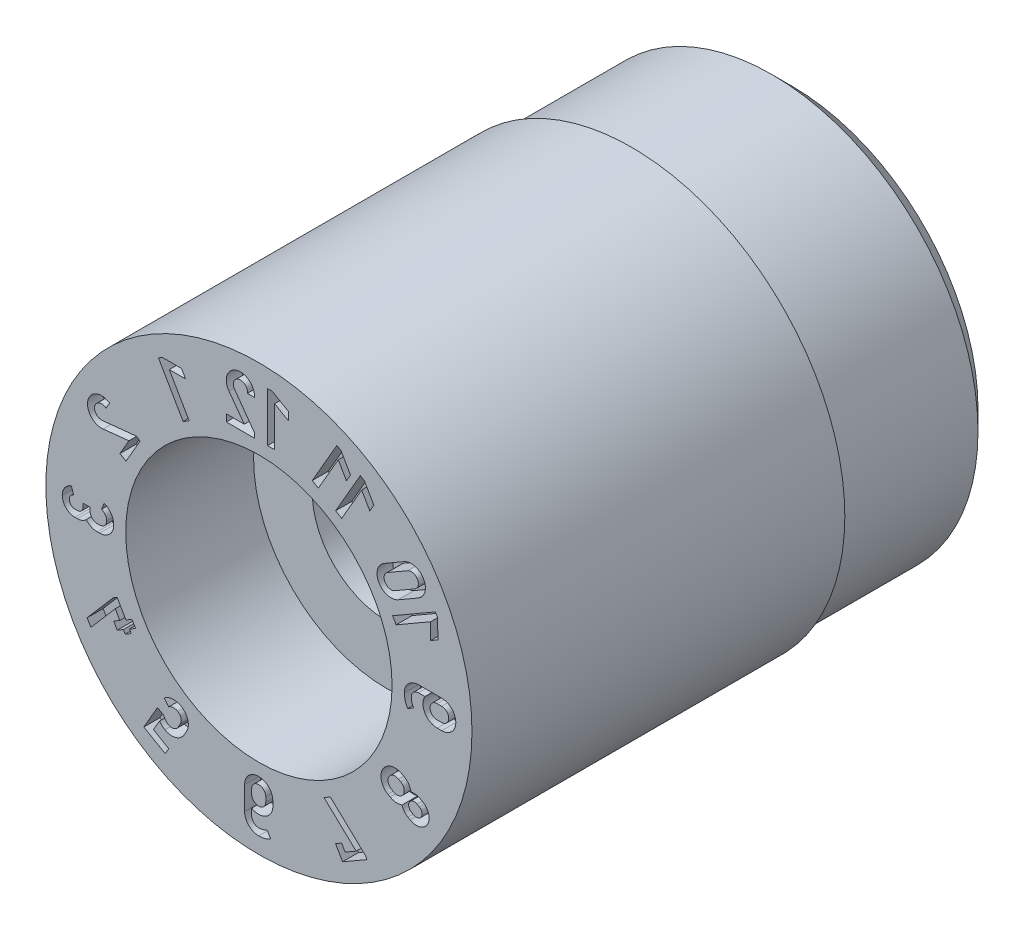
SolidWorks part; units mm, degrees
ref_plane "Front Plane" through (0, 0, 0) normal (0, 0, 1) x (1, 0, 0)
ref_plane "Top Plane" through (0, 0, 0) normal (0, 1, 0) x (1, 0, 0)
ref_plane "Right Plane" through (0, 0, 0) normal (1, 0, 0) x (0, 0, -1)
sketch "Sketch1" plane through (0, 0, 0) normal (1, 0, 0) x (0, 0, -1)
  line L2 (0, 2) -> (0, 1.25)
  line L3 (4.75, 2) -> (0, 2)
  line L4 (-3.7979, 0) -> (49996.2021, 0) construction
  line L8 (5, 0.7) -> (1.2, 0.7)
  line L9 (1.2, 1.25) -> (1.2, 0.7)
  line L10 (1.2, 1.25) -> (0, 1.25)
  line L12 (5, 0.7) -> (5, 1.75)
  line L16 (5, 1.75) -> (4.75, 2)
  dimension "D1" = 5
  dimension "D2" = 45
  dimension "D3" = 0.25
  dimension "D4" = 4
  dimension "D5" = 2.5
  dimension "D6" = 1.2
  dimension "D7" = 1.4
revolve "Revolve1" add sketch "Sketch1" angle 360 about L4
sketch "Sketch5" plane through (0, 0, 0) normal (1, 0, 0) x (0, 0, -1)
  line L0 (0, 0) -> (50000, 0) construction
  line L1 (0, 2) -> (0, -2) construction
  line L2 (3.5, 1.935) -> (5, 1.935)
  line L3 (3.5, 1.935) -> (3.5, 2.935)
  line L4 (3.5, 2.935) -> (5, 2.935)
  line L5 (5, 1.935) -> (5, 2.935)
  line L6 (5, -1.75) -> (5, 1.75) construction
  line L7 (4.75, 2) -> (0, 2) construction
  dimension "D1" = 3.5
  dimension "D2" = 0.065
  dimension "D3" = 1
revolve "Cut-Revolve1" cut sketch "Sketch5" angle 360 about L0
sketch "Sketch2" plane through (0, 0, 0) normal (0, 0, 1) x (1, 0, 0)
  line L0 (0.9518, 1.5571) -> (0.9896, 1.5353)
  line L1 (0.9896, 1.5353) -> (1.0793, 1.3805)
  line L2 (1.0793, 1.3805) -> (1.0411, 1.3144)
  line L3 (1.0411, 1.3144) -> (0.9645, 1.4466)
  line L4 (0.9645, 1.4466) -> (0.7774, 1.1225)
  line L5 (0.7774, 1.1225) -> (0.72, 1.1556)
  line L6 (0.72, 1.1556) -> (0.9518, 1.5571)
  line L7 (0.7323, 1.6929) -> (0.7701, 1.6711)
  line L8 (0.7701, 1.6711) -> (0.8598, 1.5163)
  line L9 (0.8598, 1.5163) -> (0.8216, 1.4501)
  line L10 (0.8216, 1.4501) -> (0.7449, 1.5823)
  line L11 (0.7449, 1.5823) -> (0.5578, 1.2582)
  line L12 (0.5578, 1.2582) -> (0.5005, 1.2914)
  line L13 (0.5005, 1.2914) -> (0.7323, 1.6929)
  line L14 (1.2744, 0.783) -> (1.4637, 0.8923)
  line L15 (1.3975, 1.007) -> (1.2081, 0.8977)
  line L16 (1.7158, 0.0644) -> (1.6728, 0.0644)
  line L17 (1.6728, -0.068) -> (1.7158, -0.068)
  line L18 (1.7158, 0.1307) -> (1.4972, 0.1307)
  line L19 (1.396, -0.1144) -> (1.4529, -0.0802)
  line L20 (1.7157, -0.1342) -> (1.6728, -0.1344)
  line L21 (1.558, 0.0644) -> (1.4972, 0.0644)
  line L22 (1.4321, -0.9387) -> (1.4522, -0.9502)
  line L23 (1.5052, -0.8585) -> (1.4851, -0.8469)
  line L24 (0.6108, -1.2306) -> (0.6707, -1.196)
  line L25 (0.6707, -1.196) -> (0.9988, -1.5052)
  line L26 (0.9988, -1.5052) -> (1.0147, -1.5328)
  line L27 (1.0147, -1.5328) -> (0.7853, -1.6653)
  line L28 (0.7853, -1.6653) -> (0.719, -1.5505)
  line L29 (0.719, -1.5505) -> (0.7764, -1.5174)
  line L30 (0.7764, -1.5174) -> (0.8095, -1.5748)
  line L31 (0.8095, -1.5748) -> (0.9128, -1.5152)
  line L32 (0.9128, -1.5152) -> (0.6108, -1.2306)
  line L33 (1.2448, -0.8458) -> (1.2649, -0.8574)
  line L34 (1.3311, -0.7427) -> (1.3111, -0.731)
  line L35 (1.3642, -0.6853) -> (1.3442, -0.6737)
  line L36 (1.2117, -0.9031) -> (1.2318, -0.9147)
  line L37 (1.399, -0.996) -> (1.4191, -1.0076)
  line L38 (1.5383, -0.8011) -> (1.5182, -0.7895)
  line L39 (1.6568, 0.8019) -> (1.6786, 0.7641)
  line L40 (1.6786, 0.7641) -> (1.6789, 0.5852)
  line L41 (1.6789, 0.5852) -> (1.6128, 0.547)
  line L42 (1.6128, 0.547) -> (1.6125, 0.6998)
  line L43 (1.6125, 0.6998) -> (1.2884, 0.5127)
  line L44 (1.2884, 0.5127) -> (1.2553, 0.5701)
  line L45 (1.2553, 0.5701) -> (1.6568, 0.8019)
  line L46 (1.3643, 1.0644) -> (1.175, 0.9551)
  line L47 (1.3075, 0.7256) -> (1.4968, 0.8349)
  line L48 (0.0813, 1.8293) -> (0.1249, 1.8293)
  line L49 (0.1249, 1.8293) -> (0.28, 1.7401)
  line L50 (0.28, 1.7401) -> (0.28, 1.6637)
  line L51 (0.28, 1.6637) -> (0.1475, 1.7399)
  line L52 (0.1475, 1.7399) -> (0.1475, 1.3656)
  line L53 (0.1475, 1.3656) -> (0.0813, 1.3656)
  line L54 (0.0813, 1.3656) -> (0.0813, 1.8293)
  line L55 (-0.306, 1.3646) -> (-0.041, 1.3646)
  line L56 (-0.041, 1.3646) -> (-0.041, 1.4084)
  line L57 (-0.041, 1.4084) -> (-0.2273, 1.667)
  line L58 (-0.108, 1.6958) -> (-0.0414, 1.6958)
  line L59 (-0.2811, 1.6282) -> (-0.137, 1.4309)
  line L60 (-0.137, 1.4309) -> (-0.306, 1.4309)
  line L61 (-0.306, 1.4309) -> (-0.306, 1.3646)
  line L62 (-0.9431, 1.5673) -> (-0.9054, 1.5891)
  line L63 (-0.9054, 1.5891) -> (-0.7264, 1.5894)
  line L64 (-0.7264, 1.5894) -> (-0.6882, 1.5233)
  line L65 (-0.6882, 1.5233) -> (-0.8411, 1.523)
  line L66 (-0.8411, 1.523) -> (-0.6539, 1.1989)
  line L67 (-0.6539, 1.1989) -> (-0.7113, 1.1658)
  line L68 (-0.7113, 1.1658) -> (-0.9431, 1.5673)
  line L69 (-0.068, -1.4973) -> (-0.068, -1.5403)
  line L70 (0.0644, -1.5403) -> (0.0644, -1.4973)
  line L71 (0.1306, -1.4974) -> (0.1308, -1.5403)
  line L72 (-0.068, -1.6551) -> (-0.068, -1.7159)
  line L73 (-0.1343, -1.4973) -> (-0.1343, -1.7159)
  line L74 (0.1108, -1.8171) -> (0.0766, -1.7602)
  line L75 (-0.6803, -1.3396) -> (-0.7019, -1.3769)
  line L76 (-0.9518, -1.2799) -> (-0.8944, -1.313)
  line L77 (-0.7592, -1.3438) -> (-0.7377, -1.3065)
  line L78 (-0.8474, -1.2224) -> (-0.8886, -1.1705)
  line L79 (-0.9518, -1.2799) -> (-1.0803, -1.5026)
  line L80 (-1.0803, -1.5026) -> (-0.8796, -1.6185)
  line L81 (-0.8796, -1.6185) -> (-0.8464, -1.5611)
  line L82 (-0.8464, -1.5611) -> (-0.9899, -1.4783)
  line L83 (-0.9899, -1.4783) -> (-0.9333, -1.3803)
  line L84 (-1.7268, -0.1207) -> (-1.7036, -0.1207)
  line L85 (-1.5182, -0.1339) -> (-1.495, -0.1339)
  line L86 (-1.4527, 0.131) -> (-1.477, 0.0694)
  line L87 (-1.7605, 0.1178) -> (-1.7393, 0.055)
  line L88 (-1.7268, -0.0544) -> (-1.7036, -0.0544)
  line L89 (-1.6506, -0.0014) -> (-1.6506, 0.0317)
  line L90 (-1.6506, 0.0317) -> (-1.5844, 0.0317)
  line L91 (-1.5844, 0.0317) -> (-1.5844, -0.0015)
  line L92 (-1.5182, -0.0677) -> (-1.495, -0.0677)
  line L93 (-1.6122, -0.88) -> (-1.5771, -0.9408)
  line L94 (-1.5771, -0.9408) -> (-1.3483, -0.6748)
  line L95 (-1.3483, -0.6748) -> (-1.3054, -0.7491)
  line L96 (-1.3054, -0.7491) -> (-1.3627, -0.7823)
  line L97 (-1.3627, -0.7823) -> (-1.3296, -0.8396)
  line L98 (-1.3296, -0.8396) -> (-1.2723, -0.8065)
  line L99 (-1.2723, -0.8065) -> (-1.2557, -0.8352)
  line L100 (-1.2557, -0.8352) -> (-1.1983, -0.8021)
  line L101 (-1.1983, -0.8021) -> (-1.2149, -0.7734)
  line L102 (-1.2149, -0.7734) -> (-1.1575, -0.7403)
  line L103 (-1.1575, -0.7403) -> (-1.1906, -0.6829)
  line L104 (-1.1906, -0.6829) -> (-1.248, -0.716)
  line L105 (-1.248, -0.716) -> (-1.3308, -0.5726)
  line L106 (-1.3308, -0.5726) -> (-1.3644, -0.592)
  line L107 (-1.3644, -0.592) -> (-1.6122, -0.88)
  line L108 (-1.3045, 0.6084) -> (-1.2471, 0.5753)
  line L109 (-1.2471, 0.5753) -> (-1.1147, 0.8047)
  line L110 (-1.1147, 0.8047) -> (-1.1526, 0.8266)
  line L111 (-1.1526, 0.8266) -> (-1.4697, 0.7946)
  line L112 (-1.435, 0.9123) -> (-1.4017, 0.97)
  line L113 (-1.463, 0.7286) -> (-1.2201, 0.7547)
  line L114 (-1.2201, 0.7547) -> (-1.3045, 0.6084)
  arc A0 (1.2081, 0.8977) -> (1.2744, 0.783) centre (1.2413, 0.8403) ccw
  arc A1 (1.4637, 0.8923) -> (1.3975, 1.007) centre (1.4306, 0.9496) ccw
  arc A2 (1.6728, 0.0644) -> (1.6728, -0.068) centre (1.6728, -0.0018) ccw
  arc A3 (1.7158, -0.068) -> (1.7158, 0.0644) centre (1.7158, -0.0018) ccw
  arc A4 (1.4972, 0.1307) -> (1.3648, -0.0018) centre (1.4973, -0.0018) ccw
  arc A5 (1.3648, -0.0018) -> (1.396, -0.1144) centre (1.5832, -0.0019) ccw
  arc A6 (1.7157, -0.1342) -> (1.7158, 0.1307) centre (1.7158, -0.0018) ccw
  arc A7 (1.558, 0.0644) -> (1.6728, -0.1344) centre (1.6723, -0.0021) ccw
  arc A8 (1.4972, 0.0644) -> (1.4312, 0.0033) centre (1.4972, -0.0018) ccw
  arc A9 (1.4312, 0.0033) -> (1.4529, -0.0802) centre (1.5637, -0.0069) ccw
  arc A10 (1.4851, -0.8469) -> (1.4321, -0.9387) centre (1.4586, -0.8927) ccw
  arc A11 (1.4522, -0.9502) -> (1.5052, -0.8585) centre (1.4787, -0.9043) ccw
  arc A12 (1.3111, -0.731) -> (1.2448, -0.8458) centre (1.278, -0.7884) ccw
  arc A13 (1.2649, -0.8574) -> (1.3311, -0.7427) centre (1.298, -0.8) ccw
  arc A14 (1.4285, -0.7774) -> (1.3642, -0.6853) centre (1.298, -0.8) ccw
  arc A15 (1.3442, -0.6737) -> (1.2117, -0.9031) centre (1.2779, -0.7884) ccw
  arc A16 (1.2318, -0.9147) -> (1.3437, -0.9244) centre (1.298, -0.8) ccw
  arc A17 (1.3437, -0.9244) -> (1.399, -0.996) centre (1.4588, -0.8927) ccw
  arc A18 (1.4191, -1.0076) -> (1.5383, -0.8011) centre (1.4787, -0.9044) ccw
  arc A19 (1.5182, -0.7895) -> (1.4285, -0.7774) centre (1.4588, -0.8917) ccw
  arc A20 (1.175, 0.9551) -> (1.3075, 0.7256) centre (1.2413, 0.8403) ccw
  arc A21 (1.4968, 0.8349) -> (1.3643, 1.0644) centre (1.4306, 0.9496) ccw
  arc A22 (-0.108, 1.6958) -> (-0.2273, 1.667) centre (-0.1735, 1.7057) ccw
  arc A23 (-0.0414, 1.6958) -> (-0.2811, 1.6282) centre (-0.1735, 1.7057) ccw
  arc A24 (-0.068, -1.5403) -> (0.0644, -1.5403) centre (-0.0018, -1.5403) ccw
  arc A25 (0.0644, -1.4973) -> (-0.068, -1.4973) centre (-0.0018, -1.4973) ccw
  arc A26 (0.1306, -1.4974) -> (-0.1343, -1.4973) centre (-0.0018, -1.4973) ccw
  arc A27 (-0.068, -1.6551) -> (0.1308, -1.5403) centre (-0.0015, -1.5408) ccw
  arc A28 (-0.068, -1.7159) -> (-0.0069, -1.7819) centre (-0.0018, -1.7159) ccw
  arc A29 (-0.0069, -1.7819) -> (0.0766, -1.7602) centre (0.0033, -1.6494) ccw
  arc A30 (-0.1343, -1.7159) -> (-0.0018, -1.8483) centre (-0.0018, -1.7158) ccw
  arc A31 (-0.0018, -1.8483) -> (0.1108, -1.8171) centre (-0.0017, -1.6299) ccw
  arc A32 (-0.8828, -1.4254) -> (-0.7019, -1.3769) centre (-0.8167, -1.3104) ccw
  arc A33 (-0.9333, -1.3803) -> (-0.8828, -1.4254) centre (-0.801, -1.2831) ccw
  arc A34 (-0.6803, -1.3396) -> (-0.7288, -1.1587) centre (-0.7952, -1.2734) ccw
  arc A35 (-0.7288, -1.1587) -> (-0.8886, -1.1705) centre (-0.8001, -1.2819) ccw
  arc A36 (-0.8944, -1.313) -> (-0.8497, -1.3681) centre (-0.8, -1.2819) ccw
  arc A37 (-0.8497, -1.3681) -> (-0.7592, -1.3438) centre (-0.8166, -1.3107) ccw
  arc A38 (-0.7377, -1.3065) -> (-0.7619, -1.216) centre (-0.795, -1.2734) ccw
  arc A39 (-0.7619, -1.216) -> (-0.8474, -1.2224) centre (-0.8, -1.2821) ccw
  arc A40 (-1.7605, 0.1178) -> (-1.846, -0.0014) centre (-1.7201, -0.0015) ccw
  arc A41 (-1.846, -0.0014) -> (-1.7268, -0.1207) centre (-1.7268, -0.0015) ccw
  arc A42 (-1.7036, -0.1207) -> (-1.6199, -0.0863) centre (-1.7036, -0.0015) ccw
  arc A43 (-1.6199, -0.0863) -> (-1.5182, -0.1339) centre (-1.5182, -0.0015) ccw
  arc A44 (-1.495, -0.1339) -> (-1.3625, -0.0015) centre (-1.495, -0.0015) ccw
  arc A45 (-1.3625, -0.0015) -> (-1.4527, 0.131) centre (-1.505, -0.0015) ccw
  arc A46 (-1.7393, 0.055) -> (-1.7798, -0.0014) centre (-1.7203, -0.0014) ccw
  arc A47 (-1.7798, -0.0014) -> (-1.7268, -0.0544) centre (-1.7268, -0.0014) ccw
  arc A48 (-1.7036, -0.0544) -> (-1.6506, -0.0014) centre (-1.7036, -0.0014) ccw
  arc A49 (-1.5844, -0.0015) -> (-1.5182, -0.0677) centre (-1.5182, -0.0015) ccw
  arc A50 (-1.495, -0.0677) -> (-1.4288, -0.0014) centre (-1.495, -0.0014) ccw
  arc A51 (-1.4288, -0.0014) -> (-1.477, 0.0694) centre (-1.5049, -0.0014) ccw
  arc A52 (-1.435, 0.9123) -> (-1.4697, 0.7946) centre (-1.4763, 0.8605) ccw
  arc A53 (-1.4017, 0.97) -> (-1.463, 0.7286) centre (-1.4763, 0.8605) ccw
extrude "Cut-Extrude1" cut sketch "Sketch2" against normal blind 0.15
